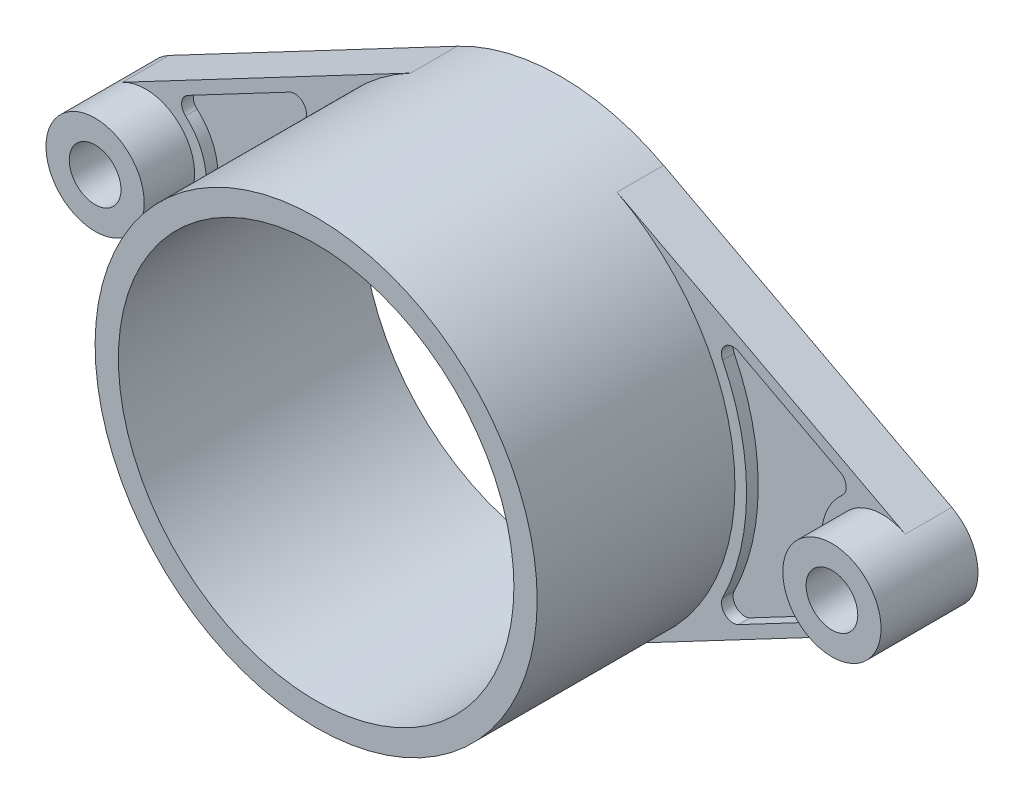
SolidWorks part; units mm, degrees
ref_plane "Front Plane" through (0, 0, 0) normal (0, 0, 1) x (1, 0, 0)
ref_plane "Top Plane" through (0, 0, 0) normal (0, 1, 0) x (1, 0, 0)
ref_plane "Right Plane" through (0, 0, 0) normal (1, 0, 0) x (0, 0, -1)
sketch "Sketch1" plane through (0, 0, 0) normal (0, 0, 1) x (1, 0, 0)
  line L0 (-95, 0) -> (95, 0) construction
  line L1 (26.6, 50.4127) -> (100.9111, 11.2028)
  line L2 (-100.9111, 11.2028) -> (-26.6, 50.4127)
  line L3 (-100.9111, -11.2028) -> (-26.6, -50.4127)
  line L4 (26.6, -50.4127) -> (100.9111, -11.2028)
  arc A0 (26.6, 50.4127) -> (-26.6, 50.4127) centre (0, 0) ccw
  arc A1 (100.9111, -11.2028) -> (100.9111, 11.2028) centre (95, 0) ccw
  arc A2 (-100.9111, 11.2028) -> (-100.9111, -11.2028) centre (-95, 0) ccw
  arc A3 (-26.6, -50.4127) -> (26.6, -50.4127) centre (0, 0) ccw
  circle A4 centre (-95, 0) radius 6.6667
  circle A5 centre (95, 0) radius 6.6667
  circle A6 centre (0, 0) radius 51
  point P13 (0, 0)
extrude "Boss-Extrude1" add sketch "Sketch1" along normal mid plane 12
sketch "Sketch2" plane through (0, 0, 6) normal (0, 0, 1) x (1, 0, 0)
  circle A0 centre (95, 0) radius 12.6667
  circle A1 centre (-95, 0) radius 12.6667
  circle A2 centre (95, 0) radius 6.6667
  circle A3 centre (-95, 0) radius 6.6667
extrude "Boss-Extrude2" add sketch "Sketch2" along normal blind 13
sketch "Sketch3" plane through (0, 0, 6) normal (0, 0, 1) x (1, 0, 0)
  circle A0 centre (0, 0) radius 57
  circle A1 centre (0, 0) radius 51
extrude "Boss-Extrude3" add sketch "Sketch3" along normal blind 51
sketch "Sketch4" plane through (0, 0, 6) normal (0, 0, 1) x (1, 0, 0)
  line L0 (26.6, -50.4127) -> (100.9111, -11.2028) construction
  line L1 (100.9111, 11.2028) -> (26.6, 50.4127) construction
  line L2 (-100.9111, -11.2028) -> (-26.6, -50.4127) construction
  line L3 (-26.6, 50.4127) -> (-100.9111, 11.2028) construction
  line L4 (26.6, -50.4127) -> (100.9111, -11.2028)
  line L5 (100.9111, 11.2028) -> (26.6, 50.4127)
  line L6 (-100.9111, -11.2028) -> (-26.6, -50.4127)
  line L7 (-26.6, 50.4127) -> (-100.9111, 11.2028)
  line L12 (-57.9121, 30.499) -> (-84.0905, 16.6861)
  line L13 (-84.0905, -16.6861) -> (-57.9121, -30.499)
  line L14 (57.9121, -30.499) -> (84.0905, -16.6861)
  line L15 (84.0905, 16.6861) -> (57.9121, 30.499)
  line L16 (48.3309, -35.5545) -> (88.6071, -14.303) construction
  line L17 (88.6071, 14.303) -> (48.3309, 35.5545) construction
  line L18 (-48.3309, 35.5545) -> (-88.6071, 14.303) construction
  line L19 (-88.6071, -14.303) -> (-48.3309, -35.5545) construction
  circle A0 centre (95, 0) radius 12.6667 construction
  arc A1 (26.6, -50.4127) -> (26.6, 50.4127) centre (0, 0) ccw construction
  arc A2 (-26.6, 50.4127) -> (-26.6, -50.4127) centre (0, 0) ccw construction
  circle A3 centre (-95, 0) radius 12.6667 construction
  arc A4 (100.9111, 11.2028) -> (100.9111, -11.2028) centre (95, 0) ccw
  arc A5 (26.6, -50.4127) -> (26.6, 50.4127) centre (0, 0) ccw
  arc A6 (-26.6, 50.4127) -> (-26.6, -50.4127) centre (0, 0) ccw
  arc A7 (-100.9111, -11.2028) -> (-100.9111, 11.2028) centre (-95, 0) ccw
  arc A12 (-84.6688, -11.7776) -> (-84.6688, 11.7776) centre (-95, 0) ccw
  arc A13 (-53.821, 26.5198) -> (-53.821, -26.5198) centre (0, 0) ccw
  arc A14 (84.6688, 11.7776) -> (84.6688, -11.7776) centre (95, 0) ccw
  arc A15 (53.821, -26.5198) -> (53.821, 26.5198) centre (0, 0) ccw
  arc A16 (48.3309, -35.5545) -> (48.3309, 35.5545) centre (0, 0) ccw construction
  arc A17 (53.821, -26.5198) -> (57.9121, -30.499) centre (56.5121, -27.8457) ccw
  arc A18 (88.6071, 14.303) -> (88.6071, -14.303) centre (95, 0) ccw construction
  arc A19 (84.0905, -16.6861) -> (84.6688, -11.7776) centre (82.6905, -14.0328) ccw
  arc A20 (84.6688, 11.7776) -> (84.0905, 16.6861) centre (82.6905, 14.0328) ccw
  arc A21 (53.821, 26.5198) -> (57.9121, 30.499) centre (56.5121, 27.8457) cw
  arc A22 (-88.6071, -14.303) -> (-88.6071, 14.303) centre (-95, 0) ccw construction
  arc A23 (-84.0905, 16.6861) -> (-84.6688, 11.7776) centre (-82.6905, 14.0328) ccw
  arc A24 (-84.6688, -11.7776) -> (-84.0905, -16.6861) centre (-82.6905, -14.0328) ccw
  arc A25 (-48.3309, 35.5545) -> (-48.3309, -35.5545) centre (0, 0) ccw construction
  arc A26 (-57.9121, -30.499) -> (-53.821, -26.5198) centre (-56.5121, -27.8457) ccw
  arc A27 (-53.821, 26.5198) -> (-57.9121, 30.499) centre (-56.5121, 27.8457) ccw
  dimension "D3" = 3
  dimension "D1" = 3
  dimension "D2" = 3
extrude "Cut-Extrude1" cut sketch "Sketch4" against normal blind 3 contours A12 A23 L12 A27 A13 A26 L13 A24 | A20 A14 A19 L14 A17 A15 A21 L15
equation "\"A\" = 38"
equation "\"B\" = 12"
equation "\"C\"= 3"
equation "\"D1@Sketch1\"=\"A\"*3"
equation "\"D2@Sketch1\"=\"A\"*5"
equation "\"D1@Boss-Extrude2\"= 25 - ( 9 + \"C\" )"
equation "\"D7@Sketch1\"=(\"A\"*3)-\"B\""
equation "\"D6@Sketch1\"=\"A\"*(2/3)-\"B\""
equation "\"D5@Sketch1\"=\"A\"*(2/3)-\"B\""
equation "\"D4@Sketch1\"=\"A\"*(2/3)"
equation "\"D3@Sketch1\"=\"A\"*(2/3)"
equation "\"D2@Sketch2\"=\"A\"*(2/3)"
equation "\"D3@Sketch2\"=\"A\"*(2/3)"
equation "\"D4@Sketch2\"=\"A\"*(2/3)-\"B\""
equation "\"D1@Sketch2\"=\"D4@Sketch2\""
equation "\"D1@Sketch3\"=\"A\"*3"
equation "\"D2@Sketch3\"=(\"A\"*3)-\"B\""
equation "\"D1@Boss-Extrude3\"=(38+25)-(9+\"C\")"
